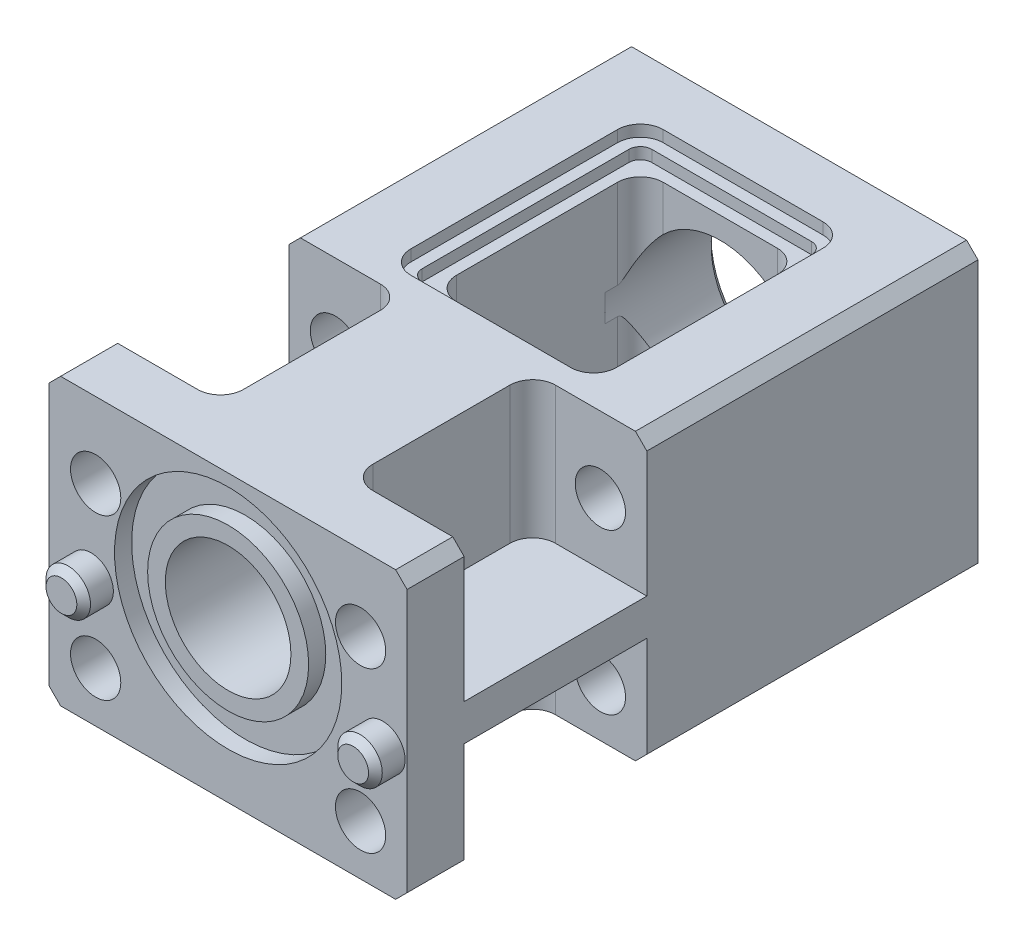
SolidWorks part; units mm, degrees
ref_plane "前视基准面" through (0, 0, 0) normal (0, 0, 1) x (1, 0, 0)
ref_plane "上视基准面" through (0, 0, 0) normal (0, 1, 0) x (1, 0, 0)
ref_plane "右视基准面" through (0, 0, 0) normal (1, 0, 0) x (0, 0, -1)
sketch "草图1" plane through (0, 0, 0) normal (0, 0, 1) x (1, 0, 0)
  line L1 (-7.835, 6.1) -> (7.835, 6.1)
  line L2 (-7.835, 6.1) -> (-7.835, -6.1)
  line L3 (-7.835, -6.1) -> (7.835, -6.1)
  line L4 (7.835, 6.1) -> (7.835, -6.1)
  line L5 (-7.835, 6.1) -> (7.835, -6.1) construction
  line L6 (-7.835, -6.1) -> (7.835, 6.1) construction
  point P0 (0, 0)
  dimension "D1" = 15.67
  dimension "D2" = 12.2
extrude "凸台-拉伸1" add sketch "草图1" along normal blind 25
sketch "草图4" plane through (0, 0, 25) normal (0, 0, 1) x (1, 0, 0)
  line L3 (6.775, -6.1) -> (6.775, -0.3) construction
  circle A0 centre (-6, -0.6) radius 0.975
  circle A1 centre (6.775, -0.6) radius 0.975
  dimension "D1" = 1.95
extrude "凸台-拉伸2" add sketch "草图4" along normal blind 1.3
chamfer "倒角1" distance 0.3 angle 45 2 edges at (7.75, -0.6, 26.3) (-5.025, -0.6, 26.3)
sketch "草图15" plane through (7.835, 0, 0) normal (1, 0, 0) x (0, 0, -1)
  line L1 (-22.5, 6.1) -> (-14.5, 6.1)
  line L2 (-22.5, 6.1) -> (-22.5, 2.1)
  line L3 (-25, 6.1) -> (0, 6.1) construction
  line L4 (-14.5, 6.1) -> (-14.5, 2.1)
  line L5 (-22.5, 4.1) -> (-6.9335, 4.1) construction
  line L6 (-25, -6.1) -> (-25, 6.1) construction
  line L8 (-25, -6.1) -> (0, -6.1) construction
  line L9 (-22.5, 2.1) -> (-22.5, -6.1)
  line L10 (-22.5, -6.1) -> (-14.5, -6.1)
  line L11 (-14.5, 2.1) -> (-14.5, -6.1)
  dimension "D1" = 4
  dimension "D3" = 2.5
  dimension "D4" = 8
extrude "切除-拉伸12" cut sketch "草图15" against normal blind 5
mirror "镜向1" about plane through (0, 0, 0) normal (1, 0, 0) of "切除-拉伸12"
sketch "草图17" plane through (0, 0, 22.5) normal (0, 0, -1) x (-1, 0, 0)
  circle A0 centre (-5.8, 3.1) radius 1.1
  circle A1 centre (-5.8, -3.9) radius 1.1
  circle A2 centre (5.8, -3.9) radius 1.1
  circle A3 centre (5.8, 3.1) radius 1.1
  dimension "D1" = 2.2
extrude "切除-拉伸13" cut sketch "草图17" against normal through all
sketch "草图19" plane through (0, 0, 25) normal (0, 0, 1) x (1, 0, 0)
  circle A0 centre (0, 0.9) radius 2.25
  dimension "D1" = 4.5
extrude "切除-拉伸15" cut sketch "草图19" against normal through all
hole_wizard "M2 螺纹孔1" positions "草图22" profile "草图21" tap size "M2" standard "GB"
sketch "草图22" plane through (0, 0, 0) normal (0, 0, -1) x (-1, 0, 0)
  point P0 (-5.8, 3.1)
  point P3 (-5.8, -3.9)
  point P6 (5.8, -3.9)
  point P9 (5.8, 3.1)
sketch "草图21" plane through (5.8, 3.1, 0) normal (1, 0, 0) x (0, 1, 0)
  line L0 (0, 0) -> (0, 14.4807)
  line L1 (0, 14.4807) -> (0.8, 14)
  line L2 (0.8, 14) -> (0.8, 0)
  line L5 (0.8, 0) -> (0, 0)
  line L10 (0, 14.4807) -> (-0.8, 14) construction
  line L11 (0, -6.35) -> (0, 107.95) construction
  dimension "螺纹孔钻头直径" = 1.6
  dimension "螺纹孔钻头深度" = 14
  dimension "导头角度" = 118
sketch "草图23" plane through (0, 6.1, 0) normal (0, 1, 0) x (1, 0, 0)
  line L0 (0, 0) -> (0, -21.2193) construction
  line L1 (-3.5, -12.5) -> (3.5, -12.5)
  line L2 (-3.5, -12.5) -> (-3.5, -3.45)
  line L3 (-3.5, -3.45) -> (3.5, -3.45)
  line L4 (3.5, -12.5) -> (3.5, -3.45)
  line L5 (7.835, 0) -> (-7.835, 0) construction
  line L6 (3, -8.95) -> (-3, -8.95) construction
  dimension "D1" = 3.5
  dimension "D2" = 3.5
  dimension "D3" = 12.5
  dimension "D4" = 5.5
extrude "切除-拉伸16" cut sketch "草图23" against normal blind 8.7
fillet "圆角6" radius 1 4 edges at (-3.5, 1.75, 3.45) (3.5, 1.75, 3.45) (3.5, 1.75, 12.5) (-3.5, 1.75, 12.5)
sketch "草图24" plane through (0, 0, 0) normal (0, 0, -1) x (-1, 0, 0)
  circle A0 centre (0, 0.9) radius 3.55
  dimension "D1" = 7.1
extrude "切除-拉伸17" cut sketch "草图24" against normal blind 5
sketch "草图30" plane through (-2.835, 0, 0) normal (-1, 0, 0) x (0, 0, 1)
  line L0 (14.5, -6.1) -> (14.5, 6.1) construction
  line L1 (14.5, 0.4) -> (22.5, 0.4)
  line L2 (14.5, 0.4) -> (14.5, -1.2)
  line L3 (14.5, -1.2) -> (22.5, -1.2)
  line L4 (22.5, 0.4) -> (22.5, -1.2)
  line L5 (22.5, 6.1) -> (22.5, -6.1) construction
  line L6 (22.5, -6.1) -> (14.5, -6.1) construction
  dimension "D1" = 4.9
extrude "凸台-拉伸4" add sketch "草图30" along normal up to surface (5 mm away)
sketch "草图31" plane through (2.835, 0, 0) normal (1, 0, 0) x (0, 0, -1)
  line L1 (-14.5, -1.2) -> (-22.5, -1.2)
  line L2 (-14.5, -1.2) -> (-14.5, 0.4)
  line L3 (-14.5, 0.4) -> (-22.5, 0.4)
  line L4 (-22.5, -1.2) -> (-22.5, 0.4)
  line L5 (-14.5, -1.2) -> (-22.5, -1.2) construction
extrude "凸台-拉伸5" add sketch "草图31" along normal up to surface (5 mm away)
sketch "草图32" plane through (0, 6.1, 0) normal (0, 1, 0) x (1, 0, 0)
  line L0 (0.5937, -3.45) -> (-0.5937, -3.45)
  line L8 (0.5937, -5) -> (-0.5937, -5)
  line L9 (-0.5937, -5) -> (-0.5937, -3.45)
  line L10 (-0.5937, -3.45) -> (-2.5, -3.45)
  line L11 (-3.5, -4.45) -> (-3.5, -11.5)
  line L12 (-2.835, -22.5) -> (-7.835, -22.5)
  line L13 (-7.835, -22.5) -> (-7.835, -25)
  line L14 (-7.835, -25) -> (7.835, -25)
  line L15 (7.835, -25) -> (7.835, -22.5)
  line L16 (7.835, -22.5) -> (2.835, -22.5)
  line L17 (2.835, -22.5) -> (2.835, -14.5)
  line L18 (2.835, -14.5) -> (7.835, -14.5)
  line L19 (7.835, -14.5) -> (7.835, 0)
  line L20 (7.835, 0) -> (-7.835, 0)
  line L21 (-7.835, 0) -> (-7.835, -14.5)
  line L22 (-7.835, -14.5) -> (-2.835, -14.5)
  line L23 (-2.835, -14.5) -> (-2.835, -22.5)
  line L24 (-2.835, -22.5) -> (-7.835, -22.5)
  line L25 (-7.835, -22.5) -> (-7.835, -25)
  line L26 (-7.835, -25) -> (7.835, -25)
  line L27 (7.835, -25) -> (7.835, -22.5)
  line L28 (7.835, -22.5) -> (2.835, -22.5)
  line L29 (2.835, -22.5) -> (2.835, -14.5)
  line L30 (2.835, -14.5) -> (7.835, -14.5)
  line L31 (7.835, -14.5) -> (7.835, 0)
  line L32 (7.835, 0) -> (-7.835, 0)
  line L33 (-7.835, 0) -> (-7.835, -14.5)
  line L34 (-7.835, -14.5) -> (-2.835, -14.5)
  line L35 (-2.835, -14.5) -> (-2.835, -22.5)
  line L36 (-2.5, -12.5) -> (2.5, -12.5)
  line L37 (3.5, -11.5) -> (3.5, -4.45)
  line L38 (2.5, -3.45) -> (0.5937, -3.45)
  line L39 (0.5937, -3.45) -> (0.5937, -5)
  line L42 (-0.5937, -3.45) -> (-2.5, -3.45)
  line L43 (-3.5, -4.45) -> (-3.5, -11.5)
  line L44 (-2.5, -12.5) -> (2.5, -12.5)
  line L45 (3.5, -11.5) -> (3.5, -4.45)
  line L46 (2.5, -3.45) -> (0.5937, -3.45)
  arc A4 (-2.5, -3.45) -> (-3.5, -4.45) centre (-2.5, -4.45) ccw
  arc A5 (-3.5, -11.5) -> (-2.5, -12.5) centre (-2.5, -11.5) ccw
  arc A6 (2.5, -12.5) -> (3.5, -11.5) centre (2.5, -11.5) ccw
  arc A7 (3.5, -4.45) -> (2.5, -3.45) centre (2.5, -4.45) ccw
  arc A8 (-2.5, -3.45) -> (-3.5, -4.45) centre (-2.5, -4.45) ccw
  arc A9 (-3.5, -11.5) -> (-2.5, -12.5) centre (-2.5, -11.5) ccw
  arc A10 (2.5, -12.5) -> (3.5, -11.5) centre (2.5, -11.5) ccw
  arc A11 (3.5, -4.45) -> (2.5, -3.45) centre (2.5, -4.45) ccw
  dimension "D1" = 0
  dimension "D2" = 0
extrude "凸台-拉伸6" add sketch "草图32" along normal blind 0.3
sketch "草图33" plane through (0, 6.4, 0) normal (0, 1, 0) x (1, 0, 0)
  line L0 (-3.5, -7.975) -> (3.5, -7.975) construction
  line L1 (-3.5, -4.45) -> (-3.5, -11.5) construction
  line L2 (3.5, -11.5) -> (3.5, -4.45) construction
  line L3 (0, -12.5) -> (0, -3.45) construction
  line L4 (-2.5, -12.5) -> (2.5, -12.5) construction
  line L5 (2.5, -3.45) -> (-2.5, -3.45) construction
  line L7 (-4.5, -13.5) -> (4.5, -13.5)
  line L8 (-4.5, -13.5) -> (-4.5, -2.45)
  line L9 (-4.5, -2.45) -> (4.5, -2.45)
  line L10 (4.5, -13.5) -> (4.5, -2.45)
  line L11 (-4.5, -13.5) -> (4.5, -2.45) construction
  line L12 (-4.5, -2.45) -> (4.5, -13.5) construction
  point P12 (0, -7.975)
  dimension "D1" = 1
  dimension "D2" = 1
extrude "切除-拉伸20" cut sketch "草图33" against normal blind 0.5
fillet "圆角8" radius 1 4 edges at (-4.5, 6.15, 2.45) (4.5, 6.15, 2.45) (4.5, 6.15, 13.5) (-4.5, 6.15, 13.5)
sketch "草图34" plane through (0, 5.9, 0) normal (0, 1, 0) x (1, 0, 0)
  line L0 (3.5, -2.95) -> (-3.5, -2.95)
  line L1 (-4, -3.45) -> (-4, -12.5)
  line L2 (-3.5, -13) -> (3.5, -13)
  line L3 (4, -12.5) -> (4, -3.45)
  line L4 (3.5, -2.45) -> (-3.5, -2.45)
  line L5 (-4.5, -3.45) -> (-4.5, -12.5)
  line L6 (-3.5, -13.5) -> (3.5, -13.5)
  line L7 (4.5, -12.5) -> (4.5, -3.45)
  line L8 (3.5, -2.45) -> (-3.5, -2.45) construction
  line L9 (-4.5, -3.45) -> (-4.5, -12.5) construction
  line L10 (-3.5, -13.5) -> (3.5, -13.5) construction
  line L11 (4.5, -12.5) -> (4.5, -3.45) construction
  arc A0 (-3.5, -2.95) -> (-4, -3.45) centre (-3.5, -3.45) ccw
  arc A1 (-4, -12.5) -> (-3.5, -13) centre (-3.5, -12.5) ccw
  arc A2 (3.5, -13) -> (4, -12.5) centre (3.5, -12.5) ccw
  arc A3 (4, -3.45) -> (3.5, -2.95) centre (3.5, -3.45) ccw
  arc A4 (-3.5, -2.45) -> (-4.5, -3.45) centre (-3.5, -3.45) ccw
  arc A5 (-4.5, -12.5) -> (-3.5, -13.5) centre (-3.5, -12.5) ccw
  arc A6 (3.5, -13.5) -> (4.5, -12.5) centre (3.5, -12.5) ccw
  arc A7 (4.5, -3.45) -> (3.5, -2.45) centre (3.5, -3.45) ccw
  arc A8 (-3.5, -2.45) -> (-4.5, -3.45) centre (-3.5, -3.45) ccw construction
  arc A9 (-4.5, -12.5) -> (-3.5, -13.5) centre (-3.5, -12.5) ccw construction
  arc A10 (3.5, -13.5) -> (4.5, -12.5) centre (3.5, -12.5) ccw construction
  arc A11 (4.5, -3.45) -> (3.5, -2.45) centre (3.5, -3.45) ccw construction
  dimension "D1" = 0
  dimension "D2" = 0.5
extrude "切除-拉伸21" cut sketch "草图34" against normal blind 0.5
fillet "圆角9" radius 1 7 edges at (2.835, -3.65, 22.5) (2.835, 3.4, 14.5) (-2.835, -3.65, 14.5) (-2.835, -3.65, 22.5) (-2.835, 3.4, 22.5) (-2.835, 3.4, 14.5) (2.835, 3.4, 22.5)
chamfer "倒角4" distance 0.5 angle 45 8 edges at (-7.835, 6.4, 7.25) (-7.835, 6.4, 23.75) (-7.835, -6.1, 7.25) (-7.835, -6.1, 23.75) (7.835, -6.1, 7.25) (7.835, -6.1, 23.75) (7.835, 6.4, 7.25) (7.835, 6.4, 23.75)
sketch "草图35" plane through (0, 0, 25) normal (0, 0, 1) x (1, 0, 0)
  line L0 (-1.75, 2.3142) -> (-1.75, -0.5142)
  line L1 (1.75, 2.3142) -> (1.75, -0.5142)
  circle A0 centre (0, 0.9) radius 2.25 construction
  arc A1 (1.75, -0.5142) -> (1.75, 2.3142) centre (0, 0.9) ccw
  arc A2 (-1.75, 2.3142) -> (-1.75, -0.5142) centre (0, 0.9) ccw
  dimension "D1" = 3.5
  dimension "D2" = 1.75
extrude "凸台-拉伸7" add sketch "草图35" against normal up to surface (12.5 mm away)
fillet "圆角10" radius 1 4 edges at (1.75, -0.5142, 18.75) (1.75, 2.3142, 18.75) (-1.75, 2.3142, 18.75) (-1.75, -0.5142, 18.75)
chamfer "倒角3" distance 0.3 angle 45 9 edges at (-3.55, 0.9, 0) (0, 3.15, 25) (-1.6444, 2.3472, 25) (1.6444, 2.3472, 25) (-1.75, 0.9, 25) (1.75, 0.9, 25) (-1.6444, -0.5472, 25) (1.6444, -0.5472, 25) (0, -1.35, 25)
sketch "草图36" plane through (0, 0, 25) normal (0, 0, 1) x (1, 0, 0)
  circle A0 centre (0, 0.9) radius 4.25 construction
  circle A1 centre (0, 0.9) radius 4.975
  circle A2 centre (0, 0.9) radius 3.525
  dimension "D1" = 8.5
  dimension "D2" = 0.725
  dimension "D3" = 0.725
extrude "切除-拉伸22" cut sketch "草图36" against normal blind 0.75
sketch "草图37" plane through (0, 0, 14.5) normal (0, 0, 1) x (1, 0, 0)
  circle A0 centre (5.8, 3.1) radius 1.1
  circle A1 centre (5.8, -3.9) radius 1.1
  circle A2 centre (-5.8, 3.1) radius 1.1 construction
  circle A3 centre (-5.8, 3.1) radius 1.1
  circle A4 centre (-5.8, -3.9) radius 1.1 construction
  circle A5 centre (-5.8, -3.9) radius 1.1
extrude "切除-拉伸23" cut sketch "草图37" against normal blind 10
sketch "草图38" plane through (0, 0, 25) normal (0, 0, 1) x (1, 0, 0)
  circle A0 centre (0, 0.9) radius 2.75
  dimension "D1" = 5.5
extrude "切除-拉伸24" cut sketch "草图38" against normal blind 20
